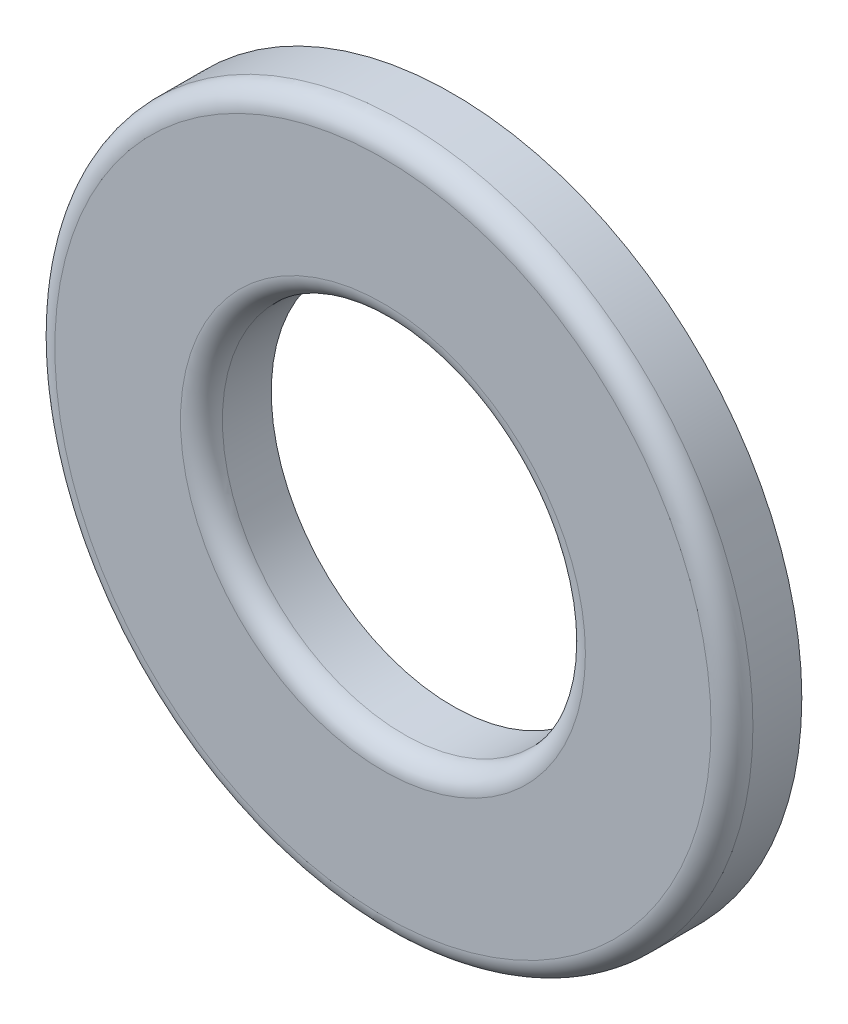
SolidWorks part; units mm, degrees
ref_plane "Plan1" through (0, 0, 0) normal (0, 0, 1) x (1, 0, 0)
ref_plane "Plan2" through (0, 0, 0) normal (0, 1, 0) x (1, 0, 0)
ref_plane "Plan3" through (0, 0, 0) normal (1, 0, 0) x (0, 0, -1)
sketch "Esquisse1" plane through (0, 0, 0) normal (0, 0, 1) x (1, 0, 0)
  circle A0 centre (0, 0) radius 2.6
  circle A1 centre (0, 0) radius 5
  dimension "D1" = 10
  dimension "D2" = 5.2
extrude "Base-Extrusion" add sketch "Esquisse1" along normal blind 1
fillet "Congé1" radius 0.3
